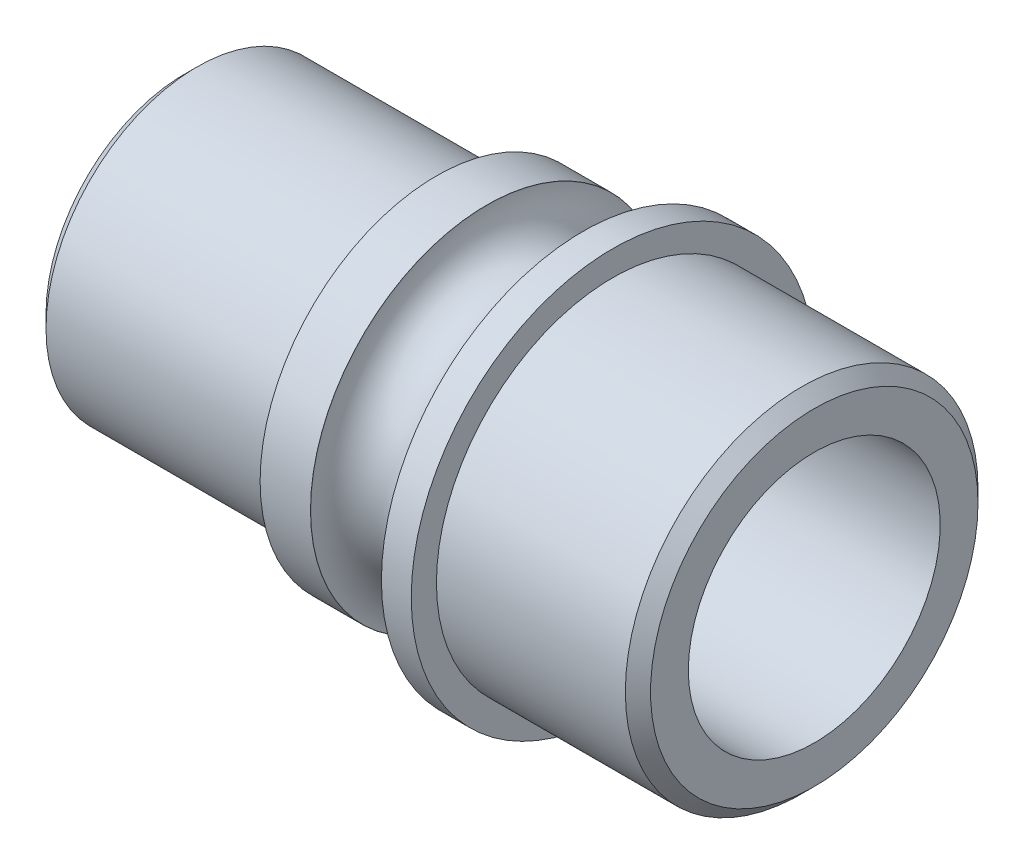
SolidWorks part; units mm, degrees
ref_plane "Plane1" through (0, 0, 0) normal (0, 0, 1) x (1, 0, 0)
ref_plane "Plane2" through (0, 0, 0) normal (0, 1, 0) x (1, 0, 0)
ref_plane "Plane3" through (0, 0, 0) normal (1, 0, 0) x (0, 0, -1)
sketch "Esquisse1" plane through (0, 0, 0) normal (0, 0, 1) x (1, 0, 0)
  line L0 (0, 0) -> (43.3446, 0) construction
  line L1 (0, 32.0545) -> (0, -12.543) construction
  line L2 (-1.1842, 8) -> (0, 8)
  line L3 (0, 8) -> (0, 7)
  line L4 (0, 7) -> (8, 7)
  line L5 (8, 7) -> (8, 5)
  line L6 (8, 5) -> (-1.1842, 5)
  line L7 (-1.1842, 5) -> (-4.071, 0)
  line L8 (-17, 0) -> (-4.071, 0)
  line L9 (-17, 0) -> (-17, 6)
  line L10 (-17, 6) -> (-7, 6)
  line L11 (-7, 6) -> (-7, 7)
  line L12 (-7, 7) -> (-5, 7)
  line L13 (-5, 7) -> (-5, 6.989)
  line L15 (-2.1334, 6.356) -> (-1.1842, 8)
  line L16 (-2.1401, 6.356) -> (-2.1334, 6.356)
  arc A0 (-5, 6.989) -> (-2.1401, 6.356) centre (-3.5, 6.989) ccw
  dimension "D11" = 3
  dimension "D1" = 60
  dimension "D2" = 7
  dimension "D3" = 8
  dimension "D4" = 8
  dimension "D5" = 5
  dimension "D6" = 6
  dimension "D7" = 7
  dimension "D8" = 17
  dimension "D9" = 10
  dimension "D10" = 2
  dimension "D12" = 1.5
revolve "Base-Révolution" add sketch "Esquisse1" angle 360 about L0
chamfer "Chanfrein1" distance 0.5 angle 45
chamfer "Chanfrein2" distance 0.5 angle 45
